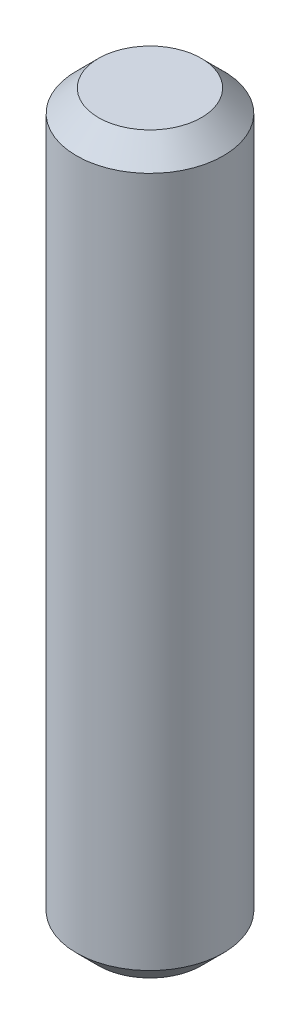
SolidWorks part; units mm, degrees
ref_plane "前视基准面" through (0, 0, 0) normal (0, 0, 1) x (1, 0, 0)
ref_plane "上视基准面" through (0, 0, 0) normal (0, 1, 0) x (1, 0, 0)
ref_plane "右视基准面" through (0, 0, 0) normal (1, 0, 0) x (0, 0, -1)
other "Configuration Table"
sketch "草图1" plane through (0, 0, 0) normal (0, 1, 0) x (1, 0, 0)
  circle A0 centre (0, 0) radius 1
  dimension "D1" = 2
extrude "凸台-拉伸1" add sketch "草图1" along normal blind 10
chamfer "倒角1" distance 0.3 angle 45 2 edges at (0, 0, 1) (0, 10, 1)
